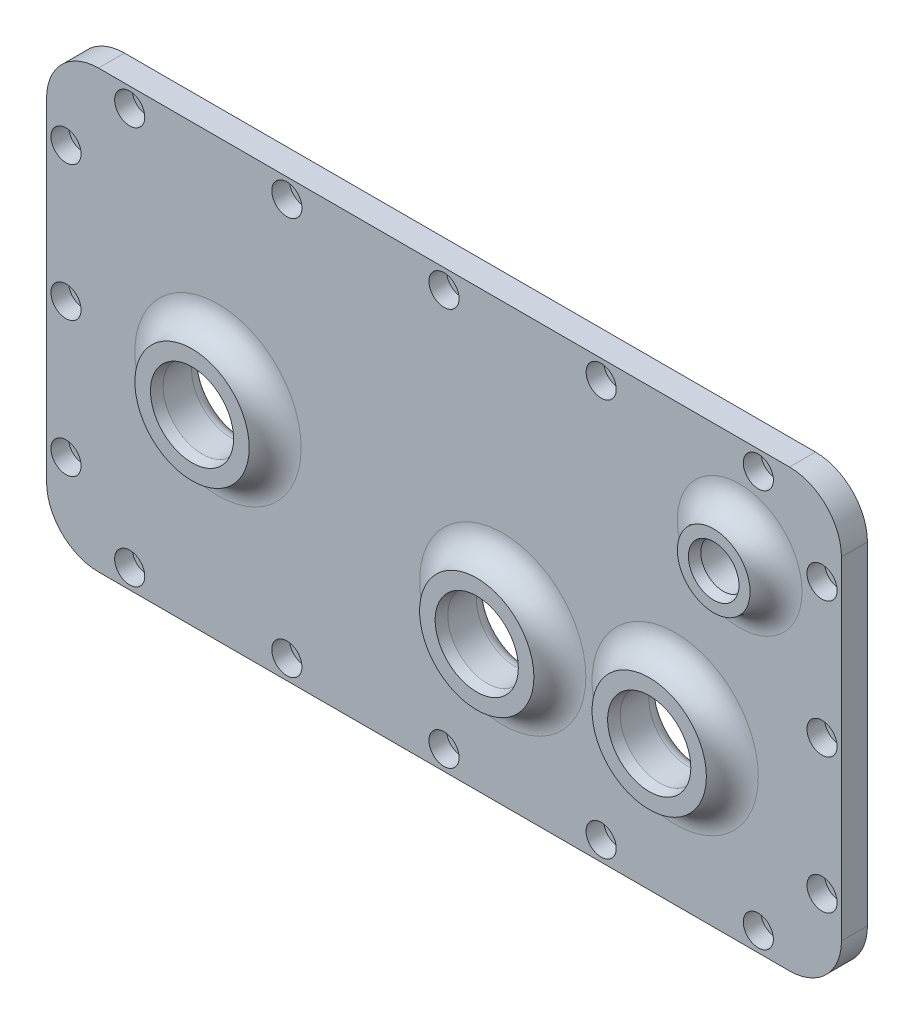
SolidWorks part; units mm, degrees
ref_plane "Front" through (0, 0, 0) normal (0, 0, 1) x (1, 0, 0)
ref_plane "Top" through (0, 0, 0) normal (0, 1, 0) x (1, 0, 0)
ref_plane "Right" through (0, 0, 0) normal (1, 0, 0) x (0, 0, -1)
sketch "Sketch1" plane through (0, 0, 0) normal (0, 0, 1) x (1, 0, 0)
  line L0 (84.455, 53.34) -> (-84.455, 53.34) construction
  line L1 (84.455, 53.34) -> (-84.455, 53.34)
  line L2 (-97.155, 40.64) -> (-97.155, -40.64) construction
  line L3 (-97.155, 40.64) -> (-97.155, -40.64)
  line L4 (97.155, -40.64) -> (97.155, 40.64) construction
  line L5 (-84.455, -53.34) -> (84.455, -53.34) construction
  line L6 (97.155, -40.64) -> (97.155, 40.64)
  line L7 (-84.455, -53.34) -> (84.455, -53.34)
  arc A0 (-84.455, 53.34) -> (-97.155, 40.64) centre (-84.455, 40.64) ccw construction
  arc A1 (-84.455, 53.34) -> (-97.155, 40.64) centre (-84.455, 40.64) ccw
  arc A2 (97.155, 40.64) -> (84.455, 53.34) centre (84.455, 40.64) ccw construction
  arc A3 (84.455, -53.34) -> (97.155, -40.64) centre (84.455, -40.64) ccw construction
  arc A4 (-97.155, -40.64) -> (-84.455, -53.34) centre (-84.455, -40.64) ccw construction
  arc A5 (97.155, 40.64) -> (84.455, 53.34) centre (84.455, 40.64) ccw
  arc A6 (84.455, -53.34) -> (97.155, -40.64) centre (84.455, -40.64) ccw
  arc A7 (-97.155, -40.64) -> (-84.455, -53.34) centre (-84.455, -40.64) ccw
extrude "Base-Extrude" add sketch "Sketch1" along normal blind 12.7
sketch "Sketch3" plane through (0, 0, 12.7) normal (0, 0, 1) x (1, 0, 0)
  circle A0 centre (-92.4052, 33.02) radius 2.159 construction
  circle A1 centre (-92.4052, 0) radius 2.159 construction
  circle A2 centre (-92.4052, -33.02) radius 2.159 construction
  circle A3 centre (-76.835, -48.5902) radius 2.159 construction
  circle A4 centre (-38.4175, -48.5902) radius 2.159 construction
  circle A5 centre (0, -48.5902) radius 2.159 construction
  circle A6 centre (38.4175, -48.5902) radius 2.159 construction
  circle A7 centre (76.835, -48.5902) radius 2.159 construction
  circle A8 centre (92.4052, -33.02) radius 2.159 construction
  circle A9 centre (92.4052, 0) radius 2.159 construction
  circle A10 centre (-76.835, 48.5902) radius 2.159 construction
  circle A11 centre (-38.4175, 48.5902) radius 2.159 construction
  circle A12 centre (0, 48.5902) radius 2.159 construction
  circle A13 centre (38.4175, 48.5902) radius 2.159 construction
  circle A14 centre (92.4052, 33.02) radius 2.159 construction
  circle A15 centre (76.835, 48.5902) radius 2.159 construction
  circle A16 centre (-92.4052, 33.02) radius 2.159
  circle A17 centre (-92.4052, 0) radius 2.159
  circle A18 centre (-92.4052, -33.02) radius 2.159
  circle A19 centre (-76.835, -48.5902) radius 2.159
  circle A20 centre (-38.4175, -48.5902) radius 2.159
  circle A21 centre (0, -48.5902) radius 2.159
  circle A22 centre (38.4175, -48.5902) radius 2.159
  circle A23 centre (76.835, -48.5902) radius 2.159
  circle A24 centre (92.4052, -33.02) radius 2.159
  circle A25 centre (92.4052, 0) radius 2.159
  circle A26 centre (-76.835, 48.5902) radius 2.159
  circle A27 centre (-38.4175, 48.5902) radius 2.159
  circle A28 centre (0, 48.5902) radius 2.159
  circle A29 centre (38.4175, 48.5902) radius 2.159
  circle A30 centre (92.4052, 33.02) radius 2.159
  circle A31 centre (76.835, 48.5902) radius 2.159
extrude "Cut-Extrude1" cut sketch "Sketch3" against normal up to surface (12.7 mm away)
sketch "Sketch21" [suppressed] plane through (0, 0, 6.35) normal (0, 0, 1) x (1, 0, 0)
  circle A0 centre (-76.835, 48.5902) radius 4.699
  circle A1 centre (-38.4175, 48.5902) radius 4.699
  circle A2 centre (0, 48.5902) radius 4.699
  circle A3 centre (38.4175, 48.5902) radius 4.699
  circle A4 centre (76.835, 48.5902) radius 4.699
  circle A5 centre (92.4052, 33.02) radius 4.699
  circle A6 centre (92.4052, 0) radius 4.699
  circle A7 centre (92.4052, -33.02) radius 4.699
  circle A8 centre (76.835, -48.5902) radius 4.699
  circle A9 centre (38.4175, -48.5902) radius 4.699
  circle A10 centre (0, -48.5902) radius 4.699
  circle A11 centre (-38.4175, -48.5902) radius 4.699
  circle A12 centre (-76.835, -48.5902) radius 4.699
  circle A13 centre (-92.4052, -33.02) radius 4.699
  circle A14 centre (-92.4052, 0) radius 4.699
  circle A15 centre (-92.4052, 33.02) radius 4.699
  dimension "D1" = 9.398
extrude "Cut-Extrude8" [suppressed] cut sketch "Sketch21" against normal blind 90.2619 draft 41
sketch "Sketch4" plane through (0, 0, 12.7) normal (0, 0, 1) x (1, 0, 0)
  circle A32 centre (-76.835, 48.5902) radius 3.683
  circle A33 centre (-38.4175, 48.5902) radius 3.683
  circle A34 centre (0, 48.5902) radius 3.683
  circle A35 centre (38.4175, 48.5902) radius 3.683
  circle A36 centre (76.835, 48.5902) radius 3.683
  circle A37 centre (92.4052, 33.02) radius 3.683
  circle A38 centre (92.4052, 0) radius 3.683
  circle A39 centre (92.4052, -33.02) radius 3.683
  circle A40 centre (76.835, -48.5902) radius 3.683
  circle A41 centre (38.4175, -48.5902) radius 3.683
  circle A42 centre (0, -48.5902) radius 3.683
  circle A43 centre (-38.4175, -48.5902) radius 3.683
  circle A44 centre (-76.835, -48.5902) radius 3.683
  circle A45 centre (-92.4052, -33.02) radius 3.683
  circle A46 centre (-92.4052, 0) radius 3.683
  circle A47 centre (-92.4052, 33.02) radius 3.683
  dimension "D1" = 7.366
extrude "Cut-Extrude2" cut sketch "Sketch4" against normal blind 10.668
hole_wizard "#4-40 Tapped Hole1" positions "Sketch6" profile "Sketch5" tap size "#4-40" standard "Ansi Inch"
sketch "Sketch6" plane through (0, 0, 0) normal (0, 0, -1) x (-1, 0, 0)
  point P0 (41.148, 12.2682)
  point P2 (-71.882, 12.2682)
  point P5 (9.5504, -18.796)
  point P7 (-26.0096, -18.796)
  point P11 (-3.429, 14.3002)
sketch "Sketch5" plane through (-41.148, 12.2682, 0) normal (1, 0, 0) x (0, 1, 0)
  line L0 (0, 0) -> (0, 5.2512)
  line L1 (0, 5.2512) -> (1.1303, 4.572)
  line L2 (1.1303, 4.572) -> (1.1303, 5.69)
  line L3 (1.1303, 5.69) -> (1.4224, 5.69)
  line L4 (1.4224, 5.69) -> (1.4224, 0)
  line L5 (1.4224, 0) -> (0, 0)
  line L10 (0, 5.2512) -> (-1.1303, 4.572) construction
  line L11 (0, -6.35) -> (0, 107.95) construction
  dimension "Tap Drill Dia." = 2.2606
  dimension "Tap Drill Depth" = 4.572
  dimension "Thread Dia." = 2.8448
  dimension "Thread Depth" = 5.69
  dimension "Drill Angle" = 118
sketch "Sketch7" plane through (0, 0, 0) normal (0, 0, -1) x (-1, 0, 0)
  line L4 (-84.455, 53.34) -> (84.455, 53.34) construction
  line L5 (-97.155, -40.64) -> (-97.155, 40.64) construction
  line L6 (97.155, 40.64) -> (97.155, -40.64) construction
  circle A0 centre (-56.515, -16.002) radius 9.6266
  circle A1 centre (-14.351, -16.002) radius 9.6266
  circle A2 centre (55.245, -2.286) radius 9.6266
  dimension "D1" = 69.342
  dimension "D3" = 69.342
  dimension "D7" = 19.2532
  dimension "D2" = 40.64
  dimension "D4" = 42.164
  dimension "D5" = 55.626
  dimension "D6" = 41.91
extrude "Cut-Extrude3" cut sketch "Sketch7" against normal through all
sketch "Sketch14" plane through (0, 0, 0) normal (0, 0, -1) x (-1, 0, 0)
  line L0 (-81.026, -37.211) -> (81.026, 37.211) construction
  line L1 (-74.676, 37.211) -> (74.676, 37.211)
  line L2 (-81.026, 30.861) -> (-81.026, -30.861)
  line L3 (-74.676, -37.211) -> (74.676, -37.211)
  line L4 (81.026, 30.861) -> (81.026, -30.861)
  line L5 (63.4339, 37.211) -> (84.5776, 37.211) construction
  line L6 (81.026, 21.0258) -> (81.026, 42.8742) construction
  line L7 (-81.026, -25.5852) -> (-81.026, -48.6082) construction
  line L8 (-65.5232, -37.211) -> (-90.6606, -37.211) construction
  line L10 (-74.676, 30.861) -> (74.676, 30.861)
  line L11 (-74.676, 30.861) -> (-74.676, -30.861)
  line L12 (-74.676, -30.861) -> (74.676, -30.861)
  line L13 (74.676, 30.861) -> (74.676, -30.861)
  line L14 (97.155, 40.64) -> (97.155, -40.64) construction
  line L15 (-84.455, 53.34) -> (84.455, 53.34) construction
  line L16 (-97.155, -40.64) -> (-97.155, 40.64) construction
  line L17 (84.455, -53.34) -> (-84.455, -53.34) construction
  arc A0 (-81.026, 30.861) -> (-74.676, 37.211) centre (-74.676, 30.861) cw
  arc A1 (-74.676, -37.211) -> (-81.026, -30.861) centre (-74.676, -30.861) cw
  arc A2 (81.026, 30.861) -> (74.676, 37.211) centre (74.676, 30.861) ccw
  arc A3 (74.676, -37.211) -> (81.026, -30.861) centre (74.676, -30.861) ccw
  dimension "D3" = 6.35
  dimension "D1" = 16.129
  dimension "D2" = 16.129
  dimension "D5" = 74.422
  dimension "D6" = 162.052
  dimension "D7" = 16.129
  dimension "D8" = 16.129
  dimension "D4" = 6.35
  dimension "D9" = 6.35
  dimension "D10" = 6.35
  dimension "D11" = 6.35
extrude "Cut- Oil moat" cut sketch "Sketch14" against normal blind 2.032
sketch "Sketch16" plane through (0, 0, 12.7) normal (0, 0, 1) x (1, 0, 0)
  line L0 (81.026, 30.861) -> (81.026, -30.861) construction
  line L1 (-74.676, 37.211) -> (74.676, 37.211) construction
  circle A0 centre (72.2757, 28.4353) radius 5.5245
  dimension "D1" = 11.049
  dimension "D2" = 3.2258
  dimension "D3" = 3.2512
extrude "Cut- Oil drain" cut sketch "Sketch16" against normal through all
sketch "Sketch8" plane through (0, 0, 12.7) normal (0, 0, 1) x (1, 0, 0)
  circle A0 centre (72.2757, 28.4353) radius 8.89
  circle A1 centre (-55.245, -2.286) radius 13.97
  circle A2 centre (14.351, -16.002) radius 13.97
  circle A3 centre (56.515, -16.002) radius 13.97
  circle A4 centre (72.2757, 28.4353) radius 5.5245 construction
  dimension "D1" = 27.94
  dimension "D2" = 17.78
extrude "Cut-Extrude4" cut sketch "Sketch8" against normal blind 6.35 flip side to cut
fillet "Fillet1" radius 6.35 4 edges at (-41.275, -2.286, 6.35) (28.321, -16.002, 6.35) (70.485, -16.002, 6.35) (81.1657, 28.4353, 6.35)
hole_wizard "#8-32 Tapped Hole1" positions "Sketch10" profile "Sketch9" tap size "#8-32" standard "ANSI Inch"
sketch "Sketch10" plane through (0, 0, 0) normal (0, 0, -1) x (-1, 0, 0)
  line L0 (74.676, -30.861) -> (74.676, 30.861) construction
  point P0 (-35.3314, -14.605)
  point P1 (11.9126, -14.605)
  point P4 (-37.465, 11.8872)
  point P6 (64.135, 24.5872)
  point P17 (-59.055, 24.5872)
  dimension "D1" = 10.541
  dimension "D2" = 123.19
sketch "Sketch9" plane through (35.3314, -14.605, 0) normal (1, 0, 0) x (0, 1, 0)
  line L0 (0, 0) -> (0, 6.1178)
  line L1 (0, 6.1178) -> (1.7272, 5.08)
  line L2 (1.7272, 5.08) -> (1.7272, 0)
  line L5 (1.7272, 0) -> (0, 0)
  line L10 (0, 6.1178) -> (-1.7272, 5.08) construction
  line L11 (0, -6.35) -> (0, 107.95) construction
  dimension "Tap Drill Dia." = 3.4544
  dimension "Tap Drill Depth" = 5.08
  dimension "Drill Angle" = 118
fillet "Fillet2" radius 3.175 3 edges at (46.8884, -16.002, 0) (4.7244, -16.002, 0) (-64.8716, -2.286, 0)
ref_plane "Plane1" through (0, -2.286, 0) normal (0, 1, 0) x (-1, 0, 0)
sketch "Sketch11" [suppressed] plane through (0, -2.286, 0) normal (0, 1, 0) x (-1, 0, 0)
  line L0 (44.9453, 12.7) -> (45.6259, 12.7)
  line L1 (45.6259, 12.7) -> (45.6259, 10.16)
  line L2 (44.9453, 12.7) -> (45.6259, 10.16)
  line L3 (64.8716, 12.7) -> (45.6184, 12.7) construction
  line L4 (69.215, 12.7) -> (41.275, 12.7) construction
  line L5 (55.245, 7.8327) -> (55.245, 20.8682) construction
  line L6 (55.245, 12.7) -> (55.245, 3.175) construction
  dimension "D1" = 20.5994
  dimension "D2" = 15
  dimension "D3" = 2.54
  dimension "D4" = 19.2382
revolve "Cut-Revolve1" [suppressed] cut sketch "Sketch11" angle 360 about L5
ref_plane "Plane2" through (0, -16.002, 0) normal (0, 1, 0) x (-1, 0, 0)
sketch "Sketch12" plane through (0, -16.002, 0) normal (0, 1, 0) x (-1, 0, 0)
  line L0 (-24.6507, 12.7) -> (-23.9701, 12.7)
  line L1 (-23.9701, 12.7) -> (-23.9701, 10.16)
  line L2 (-24.6507, 12.7) -> (-23.9701, 10.16)
  line L3 (-14.351, 7.8327) -> (-14.351, 20.8682) construction
  line L4 (-4.7244, 12.7) -> (-23.9776, 12.7) construction
  line L5 (-14.351, 12.7) -> (-14.351, 3.175) construction
  dimension "D1" = 20.5994
  dimension "D2" = 2.54
  dimension "D3" = 15
revolve "Cut-Revolve2" [suppressed] cut sketch "Sketch12" angle 360 about L3
ref_plane "Plane3" through (0, -16.002, 0) normal (0, 1, 0) x (0, 0, -1)
sketch "Sketch13" [suppressed] plane through (0, -16.002, 0) normal (0, 1, 0) x (0, 0, -1)
  line L0 (-19.0239, -56.515) -> (-2.5293, -56.515) construction
  line L1 (-12.7, -56.515) -> (-3.175, -56.515) construction
  line L2 (-12.7, -66.8147) -> (-10.16, -66.1341)
  line L3 (-10.16, -66.1341) -> (-12.7, -66.1341)
  line L6 (-12.7, -66.1341) -> (-12.7, -66.8147)
  line L7 (-12.7, -42.545) -> (-12.7, -70.485) construction
  dimension "D1" = 20.5994
  dimension "D2" = 15
  dimension "D3" = 2.54
revolve "Cut-Revolve3" [suppressed] cut sketch "Sketch13" angle 360 about L0
ref_plane "Plane4" through (0, 28.4353, 0) normal (0, 1, 0) x (-1, 0, 0)
sketch "Sketch18" [suppressed] plane through (0, 28.4353, 0) normal (0, 1, 0) x (-1, 0, 0)
  line L0 (-72.2757, 1.1764) -> (-72.2757, 13.3241) construction
  line L3 (-77.7875, 12.7) -> (-77.7875, 10.3378)
  line L4 (-77.9585, 10.3378) -> (-78.4606, 12.7)
  line L5 (-78.4606, 12.7) -> (-77.7875, 12.7)
  line L8 (-72.2757, 0) -> (-72.2757, 2.032) construction
  line L9 (-63.3857, 12.7) -> (-81.1657, 12.7) construction
  line L10 (-66.7512, 12.7) -> (-77.8002, 12.7) construction
  line L11 (-77.7875, 10.3378) -> (-77.9585, 10.3378)
  dimension "D1" = 11.0236
  dimension "D2" = 12.3698
  dimension "D3" = 2.3622
  dimension "D4" = 12
revolve "Cut-Revolve4" [suppressed] cut sketch "Sketch18" angle 360 about L0
fillet "Fillet3" [suppressed] radius 0.254
sketch "Sketch19" plane through (0, 0, 12.7) normal (0, 0, 1) x (1, 0, 0)
  line L0 (84.455, 53.34) -> (-84.455, 53.34) construction
  line L1 (97.155, -40.64) -> (97.155, 40.64) construction
  circle A0 centre (73.025, 29.21) radius 5.5245
  dimension "D3" = 11.049
  dimension "D1" = 24.13
  dimension "D2" = 24.13
extrude "Cut-Extrude7" [suppressed] cut sketch "Sketch19" against normal through all
ref_plane "Plane5" [suppressed] through (0, 29.21, 0) normal (0, 1, 0) x (-1, 0, 0)
sketch "Sketch20" [suppressed] plane through (0, 29.21, 0) normal (0, 1, 0) x (-1, 0, 0)
  line L0 (-73.025, 31.0315) -> (-73.025, 43.1792) construction
  line L1 (-78.5368, 6.35) -> (-78.5368, 3.9878)
  line L2 (-78.7078, 3.9878) -> (-79.2099, 6.35)
  line L3 (-79.2099, 6.35) -> (-78.5368, 6.35)
  line L4 (-78.5368, 3.9878) -> (-78.7078, 3.9878)
  line L5 (-73.025, 0) -> (-73.025, 6.35) construction
  line L6 (-84.455, 6.35) -> (84.455, 6.35) construction
  dimension "D1" = 12
  dimension "D2" = 12.3698
  dimension "D3" = 11.0236
  dimension "D4" = 2.3622
revolve "Cut- SAE 7/16-20" [suppressed] cut sketch "Sketch20" angle 360 about L0
fillet "Fillet4" [suppressed] radius 0.254
sketch "Sketch21- o-ring groove check" plane through (0, 0, 0) normal (0, 0, -1) x (-1, 0, 0)
  line L0 (-84.455, 53.34) -> (84.455, 53.34) construction
  line L1 (-76.962, 44.069) -> (76.962, 44.069) construction
  line L2 (-87.884, 33.147) -> (-87.884, -33.147) construction
  line L3 (-76.962, -44.069) -> (76.962, -44.069) construction
  line L4 (87.884, 33.147) -> (87.884, -33.147) construction
  line L5 (84.455, -53.34) -> (-84.455, -53.34) construction
  line L6 (-97.155, -40.64) -> (-97.155, 40.64) construction
  line L7 (97.155, 40.64) -> (97.155, -40.64) construction
  line L8 (-76.962, 39.497) -> (76.962, 39.497) construction
  line L9 (83.312, 33.147) -> (83.312, -33.147) construction
  line L10 (-76.962, -39.497) -> (76.962, -39.497) construction
  line L11 (-83.312, 33.147) -> (-83.312, -33.147) construction
  arc A0 (-76.962, 44.069) -> (-87.884, 33.147) centre (-76.962, 33.147) ccw construction
  arc A1 (87.884, 33.147) -> (76.962, 44.069) centre (76.962, 33.147) ccw construction
  arc A2 (76.962, -44.069) -> (87.884, -33.147) centre (76.962, -33.147) ccw construction
  arc A3 (-76.962, -44.069) -> (-87.884, -33.147) centre (-76.962, -33.147) cw construction
  arc A4 (83.312, 33.147) -> (76.962, 39.497) centre (76.962, 33.147) ccw construction
  arc A5 (76.962, -39.497) -> (83.312, -33.147) centre (76.962, -33.147) ccw construction
  arc A6 (-76.962, -39.497) -> (-83.312, -33.147) centre (-76.962, -33.147) cw construction
  arc A7 (-76.962, 39.497) -> (-83.312, 33.147) centre (-76.962, 33.147) ccw construction
  dimension "D5" = 10.922
  dimension "D1" = 9.271
  dimension "D2" = 9.271
  dimension "D3" = 9.271
  dimension "D4" = 9.271
  dimension "D6" = 4.572
chamfer "Chamfer1" distance 2.54 angle 12 3 edges at (46.8884, -16.002, 12.7) (4.7244, -16.002, 12.7) (-64.8716, -2.286, 12.7)
fillet "Fillet6" radius 3.175 1 edges at (68.3593, 24.5389, 0)
chamfer "Chamfer2" distance 0.6604 distance2 2.3622 1 edges at (77.8002, 28.4353, 12.7)
